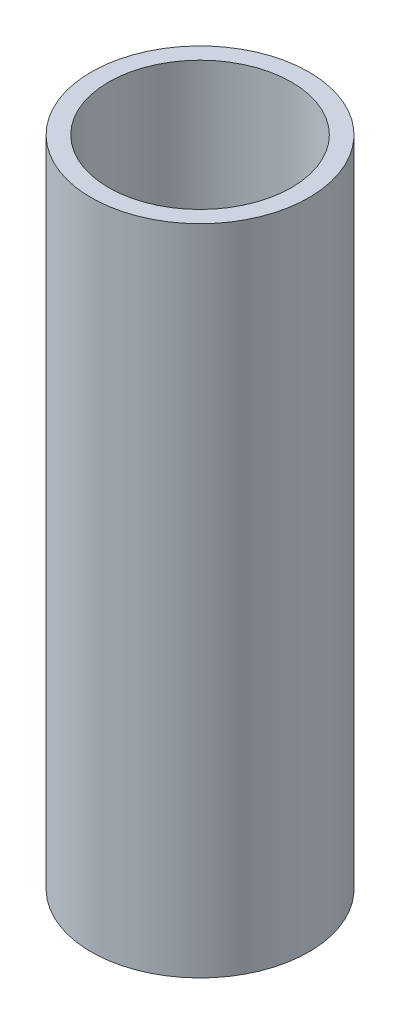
SolidWorks part; units mm, degrees
ref_plane "Front Plane" through (0, 0, 0) normal (0, 0, 1) x (1, 0, 0)
ref_plane "Top Plane" through (0, 0, 0) normal (0, 1, 0) x (1, 0, 0)
ref_plane "Right Plane" through (0, 0, 0) normal (1, 0, 0) x (0, 0, -1)
sketch "Sketch1" plane through (0, 0, 0) normal (0, 1, 0) x (1, 0, 0)
  circle A0 centre (0, 0) radius 12.7
  circle A1 centre (0, 0) radius 6.35
  dimension "D1" = 25.4
  dimension "D2" = 12.7
extrude "Boss-Extrude1" add sketch "Sketch1" along normal blind 38.1
sketch "Sketch2" plane through (0, 38.1, 0) normal (0, 1, 0) x (1, 0, 0)
  circle A0 centre (0, 0) radius 10.668
  dimension "D1" = 21.336
extrude "Cut-Extrude1" cut sketch "Sketch2" against normal blind 25.4
mirror "Mirror2" about plane through (0, 0, 0) normal (0, 1, 0) of "Cut-Extrude1", "Boss-Extrude1"
